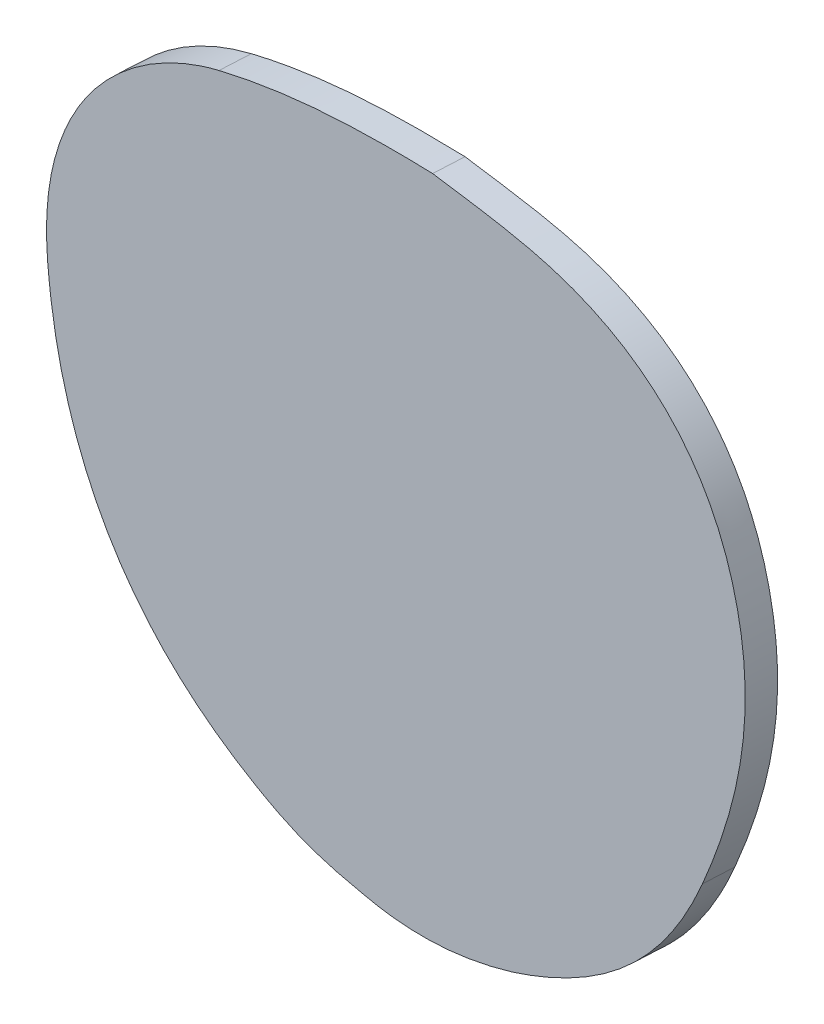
SolidWorks part; units mm, degrees
ref_plane "Front Plane" through (0, 0, 0) normal (0, 0, 1) x (1, 0, 0)
ref_plane "Top Plane" through (0, 0, 0) normal (0, 1, 0) x (1, 0, 0)
ref_plane "Right Plane" through (0, 0, 0) normal (1, 0, 0) x (0, 0, -1)
sketch "Sketch1" plane through (-1.3787, 0, 26.3073) normal (0.0523, 0, -0.9986) x (-0.9986, 0, -0.0523)
  spline S7 degree 3 poles (527.9374, -3941.6206) (-174.9079, 125.0277) (-103.4035, 3.8249) (-55.4517, 13.4834) (-54.8342, 13.6317) (-53.6206, 13.9923) (-53.023, 14.2064) (-15.3689, 29.8112) (-26.3224, 153.0003) (1683.4302, -3587.4115) knots -18.803843 -18.803843 -18.803843 -18.803843 0.25 0.25 0.5 0.5 0.75 0.75 16.58007 16.58007 16.58007 16.58007 only from (-57.9465, 13.0409) to (-50.7103, 15.2419)
  spline S8 degree 3 poles (1996.3744, -3408.8295) (-556.9291, 399.0496) (-121.1319, -46.8428) (-44.507, 19.3998) (-44.0818, 19.7948) (-43.2587, 20.6186) (-42.0786, 21.892) (-41.0597, 23.2763) (-39.8403, 25.2178) (-39.2994, 26.2379) (-38.355, 28.3647) (-37.9614, 29.4474) (-9.7038, 124.2844) (-459.2443, 335.1373) (3897.2607, -632.8445) knots -10.654953 -10.654953 -10.654953 -10.654953 0.25 0.25 0.3125 0.3125 0.375 0.5 0.5 0.625 0.625 0.75 0.75 11.412451 11.412451 11.412451 11.412451 only from (-50.7103, 15.2419) to (-36.3887, 37.3163)
  spline S9 degree 3 poles (3956.2447, 72.2132) (-604.2813, -161.7845) (-30.8878, -40.8285) (-36.4206, 41.0302) (-36.5588, 41.9511) (-37.0098, 43.7749) (-37.3156, 44.6503) (-38.0865, 46.3291) (-38.5527, 47.1339) (-39.6454, 48.6625) (-40.2555, 49.3643) (-41.2573, 50.3319) (-41.6058, 50.6402) (-42.3314, 51.2287) (-42.7098, 51.5096) (-43.8685, 52.2974) (-44.6769, 52.7545) (-45.9412, 53.3423) (-46.3713, 53.5218) (-90.1815, 69.7393) (-216.594, -82.5725) (3101.2545, -2401.0014) knots -10.81566 -10.81566 -10.81566 -10.81566 0.125 0.125 0.25 0.25 0.375 0.375 0.5 0.5 0.625 0.625 0.6875 0.6875 0.75 0.75 0.875 0.875 0.9375 0.9375 7.111297 7.111297 7.111297 7.111297 only from (-36.3887, 37.3163) to (-48.1494, 54.1181)
  spline S10 degree 3 poles (-443.5378, -3912.1599) (79.3923, -856.8455) (109.9278, 23.57) (-52.9654, 55.2034) (-54.1871, 55.391) (-56.6386, 55.6857) (-57.87, 55.7933) (-156.4692, 62.0433) (-263.8015, -114.3559) (-134.3936, 4046.5381) knots -33.096547 -33.096547 -33.096547 -33.096547 0.25 0.25 0.5 0.5 0.75 0.75 20.505836 20.505836 20.505836 20.505836 only from (-48.1494, 54.1181) to (-62.8028, 56.0271)
  spline S11 degree 3 poles (-369.5414, 4042.9973) (1.7107, 54.856) (-31.5796, 58.7574) (-64.6459, 55.8582) (-65.1068, 55.8176) (-66.4886, 55.6858) (-67.4093, 55.5853) (-69.2418, 55.3301) (-70.1511, 55.1776) (-71.9387, 54.7593) (-72.8183, 54.4983) (-74.1114, 54.0121) (-74.5381, 53.8341) (-75.3817, 53.4426) (-75.7965, 53.2299) (-77.0026, 52.5456) (-77.7621, 52.0254) (-78.8272, 51.1389) (-79.1708, 50.8247) (-79.8277, 50.1629) (-80.1376, 49.8189) (-81.0138, 48.749) (-81.5267, 47.9852) (-82.1958, 46.7684) (-82.4029, 46.3488) (-82.7789, 45.5002) (-82.9483, 45.0707) (-83.4063, 43.7678) (-83.6449, 42.8803) (-83.9188, 41.5253) (-83.9955, 41.0695) (-84.1182, 40.1492) (-84.1641, 39.686) (-84.2545, 38.3024) (-84.2526, 37.382) (-84.1346, 35.5451) (-84.0183, 34.6271) (-83.6847, 32.8006) (-83.4699, 31.9028) (-62.2251, -42.4409) (220.182, -32.2817) (-3811.9211, -1402.1765) knots -2.179222 -2.179222 -2.179222 -2.179222 0.03125 0.03125 0.0625 0.0625 0.125 0.125 0.1875 0.1875 0.25 0.25 0.28125 0.28125 0.3125 0.3125 0.375 0.375 0.40625 0.40625 0.4375 0.4375 0.5 0.5 0.53125 0.53125 0.5625 0.5625 0.625 0.625 0.65625 0.65625 0.6875 0.6875 0.75 0.75 0.8125 0.8125 0.875 0.875 6.059158 6.059158 6.059158 6.059158 only from (-62.8028, 56.0271) to (-81.3065, 25.8289)
  spline S12 degree 3 poles (-3664.3069, -1739.3179) (201.8165, 354.1332) (-122.6475, 84.223) (-78.6641, 21.2367) (-78.1955, 20.6399) (-77.1984, 19.5131) (-76.1387, 18.4494) (-74.9542, 17.5119) (-73.7089, 16.6357) (-73.0669, 16.2359) (-6.8997, -20.6354) (221.6707, 266.3816) (-1666.7203, -3646.7425) knots -12.254476 -12.254476 -12.254476 -12.254476 0.25 0.25 0.375 0.375 0.5 0.625 0.625 0.75 0.75 13.185066 13.185066 13.185066 13.185066 only from (-81.3065, 25.8289) to (-68.2782, 14.0228)
  spline S13 degree 3 poles (-1325.3183, -3778.0698) (-119.836, 345.1777) (-134.0922, 28.9315) (-64.9003, 13.1107) (-64.0365, 12.9634) (-62.2967, 12.7825) (-61.4191, 12.7492) (63.155, 16.7233) (119.4219, 1253.817) (526.434, -3922.8232) knots -19.767244 -19.767244 -19.767244 -19.767244 0.25 0.25 0.5 0.5 0.75 0.75 36.271329 36.271329 36.271329 36.271329 only from (-68.2782, 14.0228) to (-57.9465, 13.0409)
  spline S14 degree 3 poles (-57.9465, 13.0409) (-57.319, 13.1307) (-56.6938, 13.2333) (-55.4517, 13.4834) (-54.8342, 13.6317) (-53.6206, 13.9923) (-53.023, 14.2064) (-51.8521, 14.6916) (-51.2787, 14.9611) (-50.7103, 15.2419) knots 0 0 0 0 0.25 0.25 0.5 0.5 0.75 0.75 1 1 1 1
  spline S15 degree 3 poles (-50.7103, 15.2419) (-48.626, 16.2714) (-46.6903, 17.5124) (-44.507, 19.3998) (-44.0818, 19.7948) (-43.2587, 20.6186) (-42.0786, 21.892) (-41.0597, 23.2763) (-39.8403, 25.2178) (-39.2994, 26.2379) (-38.355, 28.3647) (-37.9614, 29.4474) (-36.9791, 32.7442) (-36.5867, 35.0064) (-36.3887, 37.3163) knots 0 0 0 0 0.25 0.25 0.3125 0.3125 0.375 0.5 0.5 0.625 0.625 0.75 0.75 1 1 1 1
  spline S16 degree 3 poles (-36.3887, 37.3163) (-36.3086, 38.2509) (-36.2956, 39.1808) (-36.4206, 41.0302) (-36.5588, 41.9511) (-37.0098, 43.7749) (-37.3156, 44.6503) (-38.0865, 46.3291) (-38.5527, 47.1339) (-39.6454, 48.6625) (-40.2555, 49.3643) (-41.2573, 50.3319) (-41.6058, 50.6402) (-42.3314, 51.2287) (-42.7098, 51.5096) (-43.8685, 52.2974) (-44.6769, 52.7545) (-45.9412, 53.3423) (-46.3713, 53.5218) (-47.2494, 53.8469) (-47.697, 53.9922) (-48.1494, 54.1181) knots 0 0 0 0 0.125 0.125 0.25 0.25 0.375 0.375 0.5 0.5 0.625 0.625 0.6875 0.6875 0.75 0.75 0.875 0.875 0.9375 0.9375 1 1 1 1
  spline S17 degree 3 poles (-48.1494, 54.1181) (-49.3398, 54.4495) (-50.5412, 54.7326) (-52.9654, 55.2034) (-54.1871, 55.391) (-56.6386, 55.6857) (-57.87, 55.7933) (-60.3343, 55.9495) (-61.568, 55.9983) (-62.8028, 56.0271) knots 0 0 0 0 0.25 0.25 0.5 0.5 0.75 0.75 1 1 1 1
  spline S18 degree 3 poles (-62.8028, 56.0271) (-63.2629, 55.9781) (-63.724, 55.939) (-64.6459, 55.8582) (-65.1068, 55.8176) (-66.4886, 55.6858) (-67.4093, 55.5853) (-69.2418, 55.3301) (-70.1511, 55.1776) (-71.9387, 54.7593) (-72.8183, 54.4983) (-74.1114, 54.0121) (-74.5381, 53.8341) (-75.3817, 53.4426) (-75.7965, 53.2299) (-77.0026, 52.5456) (-77.7621, 52.0254) (-78.8272, 51.1389) (-79.1708, 50.8247) (-79.8277, 50.1629) (-80.1376, 49.8189) (-81.0138, 48.749) (-81.5267, 47.9852) (-82.1958, 46.7684) (-82.4029, 46.3488) (-82.7789, 45.5002) (-82.9483, 45.0707) (-83.4063, 43.7678) (-83.6449, 42.8803) (-83.9188, 41.5253) (-83.9955, 41.0695) (-84.1182, 40.1492) (-84.1641, 39.686) (-84.2545, 38.3024) (-84.2526, 37.382) (-84.1346, 35.5451) (-84.0183, 34.6271) (-83.6847, 32.8006) (-83.4699, 31.9028) (-82.7106, 29.246) (-82.0525, 27.5234) (-81.3065, 25.8289) knots 0 0 0 0 0.03125 0.03125 0.0625 0.0625 0.125 0.125 0.1875 0.1875 0.25 0.25 0.28125 0.28125 0.3125 0.3125 0.375 0.375 0.40625 0.40625 0.4375 0.4375 0.5 0.5 0.53125 0.53125 0.5625 0.5625 0.625 0.625 0.65625 0.65625 0.6875 0.6875 0.75 0.75 0.8125 0.8125 0.875 0.875 1 1 1 1
  spline S19 degree 3 poles (-81.3065, 25.8289) (-80.6936, 24.4367) (-79.9701, 23.1069) (-78.6641, 21.2367) (-78.1955, 20.6399) (-77.1984, 19.5131) (-76.1387, 18.4494) (-74.9542, 17.5119) (-73.7089, 16.6357) (-73.0669, 16.2359) (-71.0914, 15.1351) (-69.7085, 14.5319) (-68.2782, 14.0228) knots 0 0 0 0 0.25 0.25 0.375 0.375 0.5 0.625 0.625 0.75 0.75 1 1 1 1
  spline S20 degree 3 poles (-68.2782, 14.0228) (-67.4479, 13.7431) (-66.6073, 13.501) (-64.9003, 13.1107) (-64.0365, 12.9634) (-62.2967, 12.7825) (-61.4191, 12.7492) (-59.6779, 12.8047) (-58.8106, 12.8936) (-57.9465, 13.0409) knots 0 0 0 0 0.25 0.25 0.5 0.5 0.75 0.75 1 1 1 1
  dimension "D1" = 0
extrude "Boss-Extrude1" add sketch "Sketch1" along normal blind 2
